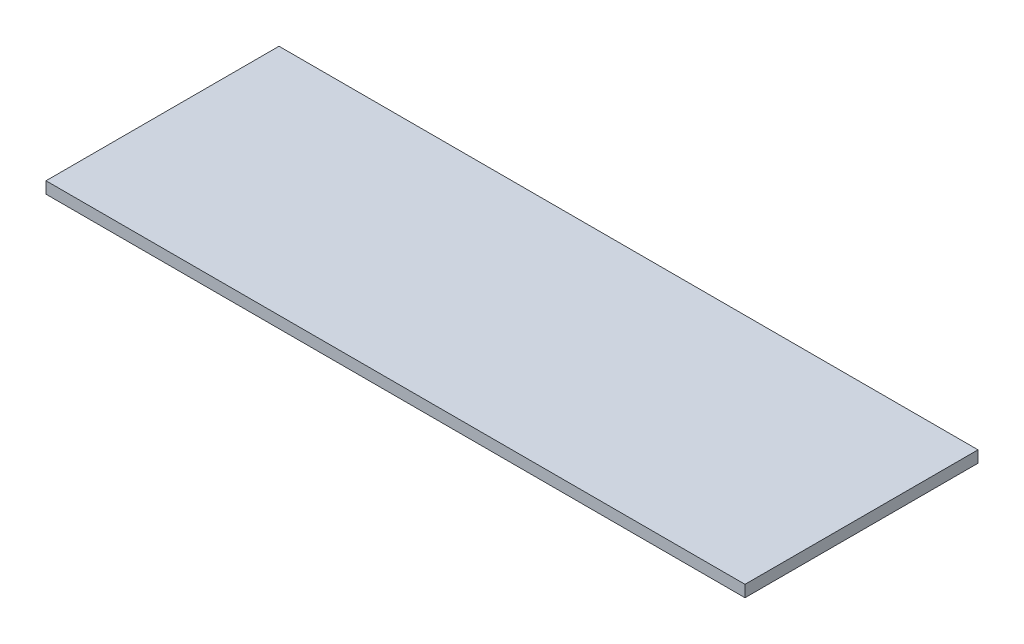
SolidWorks part; units mm, degrees
ref_plane "Plan de face" through (0, 0, 0) normal (0, 0, 1) x (1, 0, 0)
ref_plane "Plan de dessus" through (0, 0, 0) normal (0, 1, 0) x (1, 0, 0)
ref_plane "Plan de droite" through (0, 0, 0) normal (1, 0, 0) x (0, 0, -1)
sketch "Esquisse1" plane through (0, 0, 0) normal (0, 0, 1) x (1, 0, 0)
  line L1 (0, 0) -> (3000, 0)
  line L2 (0, 0) -> (0, 50)
  line L3 (0, 50) -> (3000, 50)
  line L4 (3000, 0) -> (3000, 50)
  dimension "D1" = 3000
  dimension "D2" = 50
extrude "Boss.-Extru.1" add sketch "Esquisse1" along normal blind 1000
sketch "Esquisse2" plane through (0, 50, 0) normal (0, 1, 0) x (1, 0, 0)
  line L0 (661.7012, 0) -> (661.7012, -1000)
  line L1 (3000, 0) -> (0, 0) construction
  line L2 (3000, -1000) -> (0, -1000) construction
